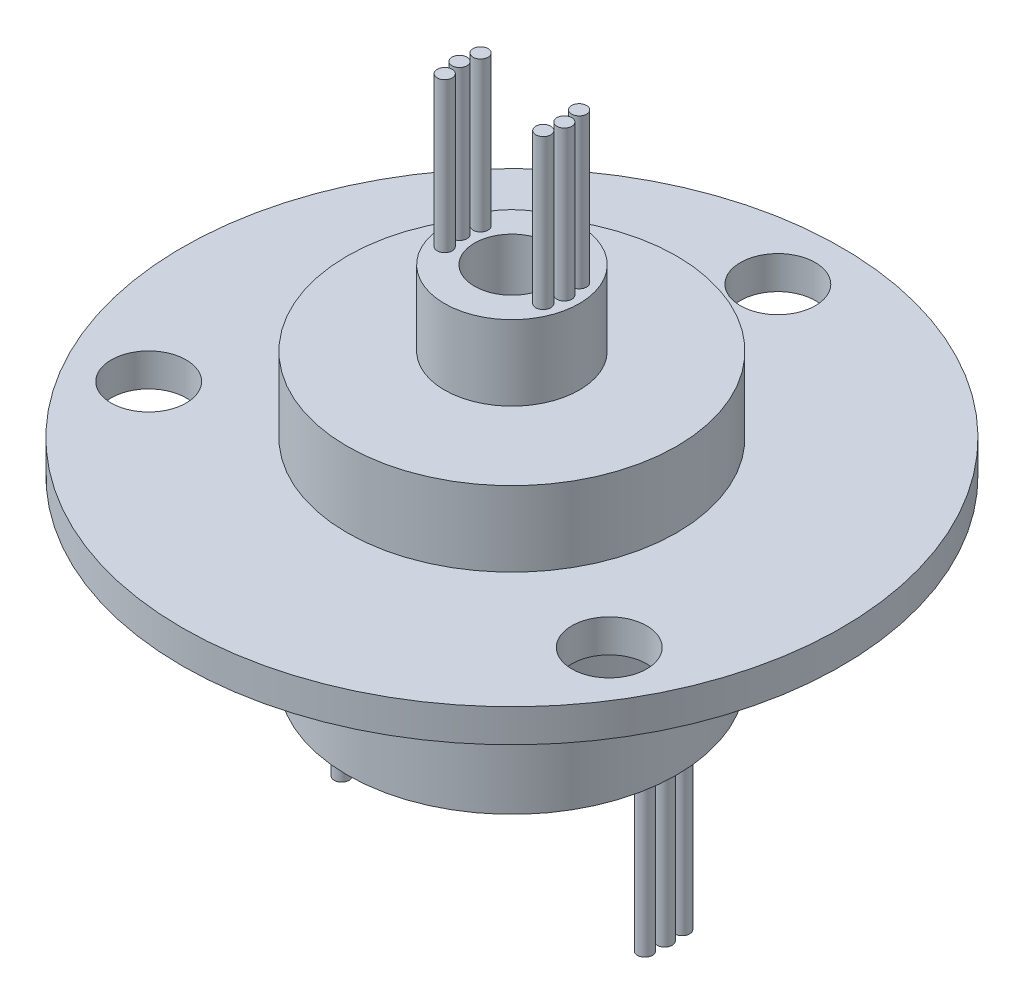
SolidWorks part; units mm, degrees
ref_plane "前基準面" through (0, 0, 0) normal (0, 0, 1) x (1, 0, 0)
ref_plane "上基準面" through (0, 0, 0) normal (0, 1, 0) x (1, 0, 0)
ref_plane "右基準面" through (0, 0, 0) normal (1, 0, 0) x (0, 0, -1)
sketch "草圖1" plane through (0, 0, 0) normal (0, 1, 0) x (1, 0, 0)
  line L0 (0, 0) -> (0, 22) construction
  line L1 (0, 0) -> (19.0526, -11) construction
  line L3 (-19.0526, -11) -> (0, 0) construction
  circle A0 centre (0, 0) radius 22
  circle A1 centre (0, 17.75) radius 2.5
  circle A2 centre (15.372, -8.875) radius 2.5
  circle A3 centre (-15.372, -8.875) radius 2.5
  point P14 (0, 0)
  dimension "D1" = 44
  dimension "D4" = 5
  dimension "D5" = 17.75
  dimension "D6" = 3
  dimension "D2" = 120
  dimension "D3" = 120
extrude "填料-伸長1" add sketch "草圖1" along normal blind 2.2
sketch "草圖2" plane through (0, 2.2, 0) normal (0, 1, 0) x (1, 0, 0)
  circle A0 centre (0, 0) radius 11
  dimension "D1" = 22
extrude "填料-伸長2" add sketch "草圖2" along normal blind 5
sketch "草圖3" plane through (0, 7.2, 0) normal (0, 1, 0) x (1, 0, 0)
  circle A0 centre (0, 0) radius 4.5
  dimension "D1" = 9
extrude "填料-伸長3" add sketch "草圖3" along normal blind 5
sketch "草圖4" plane through (0, 0, 0) normal (0, -1, 0) x (1, 0, 0)
  circle A0 centre (0, 0) radius 11
  dimension "D1" = 22
extrude "填料-伸長4" add sketch "草圖4" along normal blind 11.8
sketch "草圖5" plane through (0, 12.2, 0) normal (0, 1, 0) x (1, 0, 0)
  circle A0 centre (0, 0) radius 2.5
  dimension "D1" = 5
extrude "除料-伸長1" cut sketch "草圖5" against normal through all
sketch "草圖6" plane through (0, 12.2, 0) normal (0, 1, 0) x (1, 0, 0)
  line L0 (0, 4.5) -> (0, -4.5) construction
  line L1 (-2.5, 0) -> (-4.5, 0) construction
  circle A0 centre (0, 0) radius 4.5 construction
  circle A1 centre (0, 0) radius 4.5 construction
  circle A2 centre (0, 0) radius 2.5 construction
  circle A3 centre (-3.5, 0) radius 0.5
  circle A4 centre (-3.2889, 1.1971) radius 0.5
  circle A5 centre (-3.2889, -1.1971) radius 0.5
  circle A6 centre (3.2889, -1.1971) radius 0.5
  circle A7 centre (3.5, 0) radius 0.5
  circle A8 centre (3.2889, 1.1971) radius 0.5
  point P19 (0, 0)
  dimension "D1" = 1
  dimension "D2" = 2
extrude "填料-伸長5" add sketch "草圖6" along normal blind 10
sketch "草圖7" plane through (0, -11.8, 0) normal (0, -1, 0) x (1, 0, 0)
  line L0 (0, 11) -> (0, -11) construction
  line L1 (-2.5, 0) -> (-11, 0) construction
  circle A0 centre (0, 0) radius 11 construction
  circle A1 centre (0, 0) radius 11 construction
  circle A2 centre (0, 0) radius 2.5 construction
  circle A3 centre (-10.1987, 0) radius 0.5
  circle A4 centre (-10.1227, 1.2429) radius 0.5
  circle A5 centre (-10.1227, -1.2429) radius 0.5
  circle A6 centre (10.1227, -1.2429) radius 0.5
  circle A7 centre (10.1987, 0) radius 0.5
  circle A8 centre (10.1227, 1.2429) radius 0.5
  point P17 (0, 0)
  dimension "D1" = 1
  dimension "D2" = 2
extrude "填料-伸長6" add sketch "草圖7" along normal blind 10
